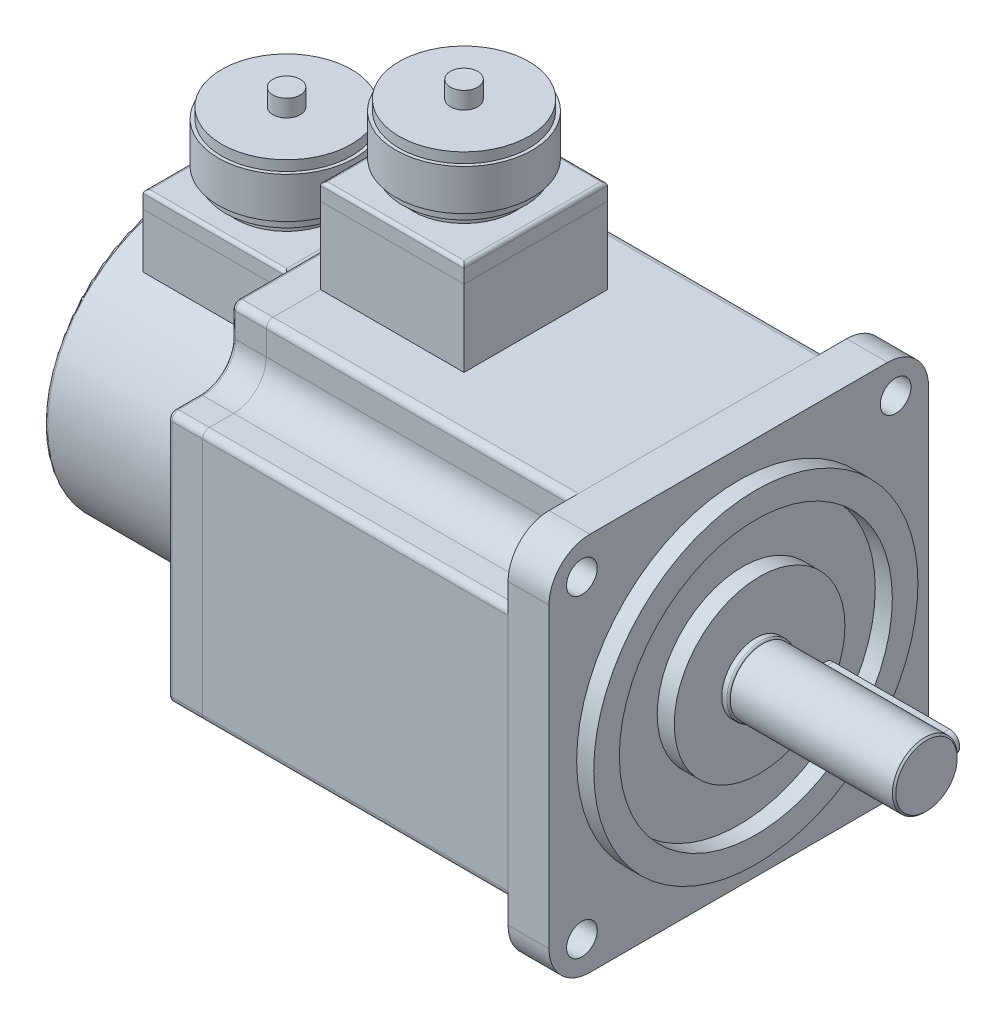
SolidWorks part; units mm, degrees
ref_plane "前视基准面" through (0, 0, 0) normal (0, 0, 1) x (1, 0, 0)
ref_plane "上视基准面" through (0, 0, 0) normal (0, 1, 0) x (1, 0, 0)
ref_plane "右视基准面" through (0, 0, 0) normal (1, 0, 0) x (0, 0, -1)
sketch "草图1" plane through (0, 0, 0) normal (1, 0, 0) x (0, 0, -1)
  line L1 (-43.6, -55.6) -> (43.6, -55.6)
  line L2 (-55.6, -43.6) -> (-55.6, 43.6)
  line L3 (-43.6, 55.6) -> (43.6, 55.6)
  line L4 (55.6, -43.6) -> (55.6, 43.6)
  line L5 (-55.6, -55.6) -> (55.6, 55.6) construction
  line L6 (-55.6, 55.6) -> (55.6, -55.6) construction
  arc A0 (-43.6, -55.6) -> (-55.6, -43.6) centre (-43.6, -43.6) cw
  arc A1 (43.6, -55.6) -> (55.6, -43.6) centre (43.6, -43.6) ccw
  arc A2 (43.6, 55.6) -> (55.6, 43.6) centre (43.6, 43.6) cw
  arc A3 (-55.6, 43.6) -> (-43.6, 55.6) centre (-43.6, 43.6) cw
  point P0 (0, 0)
  dimension "D1" = 12
extrude "凸台-拉伸1" add sketch "草图1" along normal blind 10
sketch "草图2" plane through (10, 0, 0) normal (1, 0, 0) x (0, 0, -1)
  line L0 (43.6, 55.6) -> (-43.6, 55.6) construction
  line L1 (-43.6, -55.6) -> (43.6, -55.6)
  line L2 (-55.6, -43.6) -> (-55.6, 43.6)
  line L3 (-43.6, 55.6) -> (43.6, 55.6)
  line L4 (55.6, -43.6) -> (55.6, 43.6)
  line L5 (-55.6, -55.6) -> (55.6, 55.6) construction
  line L6 (-55.6, 55.6) -> (55.6, -55.6) construction
  arc A0 (43.6, 55.6) -> (55.6, 43.6) centre (43.6, 43.6) cw
  arc A1 (43.6, -55.6) -> (55.6, -43.6) centre (43.6, -43.6) ccw
  arc A2 (-43.6, -55.6) -> (-55.6, -43.6) centre (-43.6, -43.6) cw
  arc A3 (-55.6, 43.6) -> (-43.6, 55.6) centre (-43.6, 43.6) cw
  point P0 (0, 0)
  dimension "D1" = 12
extrude "凸台-拉伸2" add sketch "草图2" along normal blind 89.5 separate body
sketch "草图3" plane through (99.5, 0, 0) normal (1, 0, 0) x (0, 0, -1)
  line L0 (43.6, 55.6) -> (-43.6, 55.6) construction
  line L1 (-43.6, -55.6) -> (43.6, -55.6)
  line L2 (-55.6, -43.6) -> (-55.6, 43.6)
  line L3 (-43.6, 55.6) -> (43.6, 55.6)
  line L4 (55.6, -43.6) -> (55.6, 43.6)
  line L5 (-55.6, -55.6) -> (55.6, 55.6) construction
  line L6 (-55.6, 55.6) -> (55.6, -55.6) construction
  arc A0 (43.6, 55.6) -> (55.6, 43.6) centre (43.6, 43.6) cw
  arc A1 (43.6, -55.6) -> (55.6, -43.6) centre (43.6, -43.6) ccw
  arc A2 (-43.6, -55.6) -> (-55.6, -43.6) centre (-43.6, -43.6) cw
  arc A3 (-55.6, 43.6) -> (-43.6, 55.6) centre (-43.6, 43.6) cw
  point P0 (0, 0)
  dimension "D1" = 12
extrude "凸台-拉伸3" add sketch "草图3" along normal blind 12 separate body
sketch "草图6" plane through (0, 0, 0) normal (-1, 0, 0) x (0, 0, 1)
  line L0 (-46.5, 36.9491) -> (-53.6, 36.9491)
  line L1 (-55.6, 34.9491) -> (-55.6, 43.6)
  line L3 (-43.6, 55.6) -> (-34.9491, 55.6)
  line L4 (34.9491, 55.6) -> (43.6, 55.6)
  line L6 (55.6, 43.6) -> (55.6, 34.9491)
  line L7 (-55.6, -43.6) -> (-55.6, 43.6) construction
  line L9 (-53.6, -36.9491) -> (-46.5, -36.9491)
  line L10 (55.6, -34.9491) -> (55.6, -43.6)
  line L11 (-36.9491, -46.5) -> (-36.9491, -53.6)
  line L12 (43.6, -55.6) -> (-43.6, -55.6) construction
  line L14 (36.9491, -53.6) -> (36.9491, -46.5)
  line L16 (46.5, -36.9491) -> (53.6, -36.9491)
  line L17 (55.6, 43.6) -> (55.6, -43.6) construction
  line L19 (53.6, 36.9491) -> (46.5, 36.9491)
  line L20 (43.6, -55.6) -> (34.9491, -55.6)
  line L21 (36.9491, 46.5) -> (36.9491, 53.6)
  line L24 (-43.6, 55.6) -> (43.6, 55.6) construction
  line L25 (-36.9491, 53.6) -> (-36.9491, 46.5)
  line L26 (-34.9491, -55.6) -> (-43.6, -55.6)
  line L28 (-55.6, -43.6) -> (-55.6, -34.9491)
  arc A0 (-46.5, 36.9491) -> (-36.9491, 46.5) centre (-46.5, 46.5) ccw
  arc A1 (36.9491, 46.5) -> (46.5, 36.9491) centre (46.5, 46.5) ccw
  arc A2 (-36.9491, -46.5) -> (-46.5, -36.9491) centre (-46.5, -46.5) ccw
  arc A3 (46.5, -36.9491) -> (36.9491, -46.5) centre (46.5, -46.5) ccw
  arc A4 (-34.9491, 55.6) -> (-36.9491, 53.6) centre (-34.9491, 53.6) ccw
  arc A5 (36.9491, 53.6) -> (34.9491, 55.6) centre (34.9491, 53.6) ccw
  arc A6 (55.6, 34.9491) -> (53.6, 36.9491) centre (53.6, 34.9491) ccw
  arc A7 (53.6, -36.9491) -> (55.6, -34.9491) centre (53.6, -34.9491) ccw
  arc A8 (34.9491, -55.6) -> (36.9491, -53.6) centre (34.9491, -53.6) ccw
  arc A9 (-36.9491, -53.6) -> (-34.9491, -55.6) centre (-34.9491, -53.6) ccw
  arc A10 (-55.6, -34.9491) -> (-53.6, -36.9491) centre (-53.6, -34.9491) ccw
  arc A11 (-53.6, 36.9491) -> (-55.6, 34.9491) centre (-53.6, 34.9491) ccw
  arc A12 (-43.6, 55.6) -> (-55.6, 43.6) centre (-43.6, 43.6) ccw
  arc A13 (55.6, 43.6) -> (43.6, 55.6) centre (43.6, 43.6) ccw
  arc A14 (43.6, -55.6) -> (55.6, -43.6) centre (43.6, -43.6) ccw
  arc A15 (-55.6, -43.6) -> (-43.6, -55.6) centre (-43.6, -43.6) ccw
  point P0 (0, 0)
  point P10 (-36.9491, 55.6)
  point P41 (55.6, 36.9491)
  point P44 (55.6, -36.9491)
  point P47 (36.9491, -55.6)
  point P50 (-36.9491, -55.6)
  point P53 (-55.6, -36.9491)
  point P56 (-55.6, 36.9491)
  dimension "D1" = 2
extrude "切除-拉伸1" cut sketch "草图6" against normal blind 99.5
fillet "圆角1" radius 1 24 edges at (0, 55.6, 0) (0, 55.0142, 36.3633) (0, 50.05, 36.9491) (0, 39.7465, 39.7465) (0, 36.9491, 50.05) (0, 36.3633, 55.0142) (0, 0, 55.6) (0, -36.3633, 55.0142) (0, -36.9491, 50.05) (0, -39.7465, 39.7465) (0, -50.05, 36.9491) (0, -55.0142, 36.3633) (0, -55.6, 0) (0, -55.0142, -36.3633) (0, -50.05, -36.9491) (0, -39.7465, -39.7465) (0, -36.9491, -50.05) (0, -36.3633, -55.0142) (0, 0, -55.6) (0, 36.3633, -55.0142) (0, 36.9491, -50.05) (0, 39.7465, -39.7465) (0, 50.05, -36.9491) (0, 55.0142, -36.3633)
sketch "草图7" plane through (111.5, 0, 0) normal (1, 0, 0) x (0, 0, -1)
  circle A2 centre (-45.9619, 45.9619) radius 4.5
  circle A3 centre (45.9619, 45.9619) radius 4.5
  circle A4 centre (45.9619, -45.9619) radius 4.5
  circle A5 centre (-45.9619, -45.9619) radius 4.5
extrude "切除-拉伸2" cut sketch "草图7" against normal blind 12
sketch "草图8" plane through (111.5, 0, 0) normal (1, 0, 0) x (0, 0, -1)
  circle A0 centre (0, 0) radius 47.5
  circle A1 centre (0, 0) radius 40
  circle A2 centre (1.1033, 0) radius 25
extrude "凸台-拉伸4" add sketch "草图8" along normal blind 5 contours A0 A1 | A2
sketch "草图9" plane through (116.5, 0, 0) normal (1, 0, 0) x (0, 0, -1)
  circle A0 centre (0, 0) radius 10
extrude "凸台-拉伸5" add sketch "草图9" along normal blind 2 separate body
sketch "草图10" plane through (118.5, 0, 0) normal (1, 0, 0) x (0, 0, -1)
  circle A0 centre (0, 0) radius 9.5
extrude "凸台-拉伸6" add sketch "草图10" along normal blind 48 separate body
fillet "圆角2" radius 0.5 1 edges at (118.5, 0, -10)
ref_plane "基准面1" through (0, 0, -9.75) normal (0, 0, 1) x (1, 0, 0)
sketch "草图11" plane through (0, 0, -9.75) normal (0, 0, 1) x (1, 0, 0)
  line L5 (161, 3) -> (127, 3)
  line L7 (127, -3) -> (161, -3)
  arc A0 (161, -3) -> (161, 3) centre (161, 0) ccw
  arc A1 (127, 3) -> (127, -3) centre (127, 0) ccw
chamfer "倒角1" distance 0.5 angle 45 1 edges at (166.5, 0, -9.5)
sketch "草图13" plane through (0, 0, 0) normal (-1, 0, 0) x (0, 0, 1)
  circle A0 centre (0, 0) radius 40
extrude "凸台-拉伸8" add sketch "草图13" along normal blind 52 separate body
ref_plane "基准面2" through (0, 40, 0) normal (0, 1, 0) x (1, 0, 0)
sketch "草图14" plane through (0, 40, 0) normal (0, 1, 0) x (1, 0, 0)
  line L2 (-42, -21) -> (0, -21)
  line L3 (-42, -21) -> (-42, 21)
  line L4 (-42, 21) -> (0, 21)
  line L5 (0, -21) -> (0, 21)
  line L6 (-42, -21) -> (0, 21) construction
  line L7 (-42, 21) -> (0, -21) construction
extrude "切除-拉伸4" cut sketch "草图14" against normal blind 10
sketch "草图15" plane through (0, 30, 0) normal (0, 1, 0) x (1, 0, 0)
  line L1 (-42, -21) -> (0, -21)
  line L2 (-42, -21) -> (-42, 21)
  line L3 (-42, 21) -> (0, 21)
  line L4 (0, -21) -> (0, 21)
  line L5 (-42, -21) -> (0, 21) construction
  line L6 (-42, 21) -> (0, -21) construction
  point P0 (-21, 0)
extrude "凸台-拉伸9" add sketch "草图15" along normal blind 20
sketch "草图16" plane through (0, 50, 0) normal (0, 1, 0) x (1, 0, 0)
  line L0 (-42, 21) -> (0, 21) construction
  line L1 (-42, -21) -> (0, -21)
  line L2 (-42, -21) -> (-42, 21)
  line L3 (-42, 21) -> (0, 21)
  line L4 (0, -21) -> (0, 21)
  line L5 (-42, -21) -> (0, 21) construction
  line L6 (-42, 21) -> (0, -21) construction
  line L7 (0, 21) -> (-42, 21) construction
  point P0 (-21, 0)
extrude "凸台-拉伸10" add sketch "草图16" along normal blind 5 separate body
fillet "圆角3" radius 1 4 edges at (-21, 55, 21) (-42, 55, 0) (-21, 55, -21) (0, 55, 0)
sketch "草图17" plane through (0, 55, 0) normal (0, 1, 0) x (1, 0, 0)
  circle A0 centre (-21, 0) radius 15
extrude "凸台-拉伸11" add sketch "草图17" along normal blind 3 separate body
sketch "草图18" plane through (0, 58, 0) normal (0, 1, 0) x (1, 0, 0)
  circle A0 centre (-21, 0) radius 18
extrude "凸台-拉伸12" add sketch "草图18" along normal blind 3
sketch "草图19" plane through (0, 61, 0) normal (0, 1, 0) x (1, 0, 0)
  circle A0 centre (-21, 0) radius 20
extrude "凸台-拉伸13" add sketch "草图19" along normal blind 12
sketch "草图20" plane through (0, 73, 0) normal (0, 1, 0) x (1, 0, 0)
  circle A0 centre (-21, 0) radius 19
extrude "凸台-拉伸14" add sketch "草图20" along normal blind 3
sketch "草图21" plane through (0, 76, 0) normal (0, 1, 0) x (1, 0, 0)
  circle A0 centre (-21, 0) radius 4
extrude "凸台-拉伸15" add sketch "草图21" along normal blind 5
sketch "草图22" plane through (0, 55.6, 0) normal (0, 1, 0) x (1, 0, 0)
  line L3 (10, -21) -> (52, -21)
  line L4 (10, -21) -> (10, 21)
  line L5 (10, 21) -> (52, 21)
  line L6 (52, -21) -> (52, 21)
  line L7 (10, -21) -> (52, 21) construction
  line L8 (10, 21) -> (52, -21) construction
extrude "凸台-拉伸16" add sketch "草图22" along normal blind 22.4 separate body
sketch "草图23" plane through (0, 78, 0) normal (0, 1, 0) x (1, 0, 0)
  line L2 (52, 21) -> (10, 21) construction
  line L4 (10, -21) -> (52, -21)
  line L5 (10, -21) -> (10, 21)
  line L6 (10, 21) -> (52, 21)
  line L7 (52, -21) -> (52, 21)
  line L8 (10, -21) -> (52, 21) construction
  line L9 (10, 21) -> (52, -21) construction
  point P6 (31, 0)
extrude "凸台-拉伸17" add sketch "草图23" along normal blind 5 separate body
fillet "圆角4" radius 1 4 edges at (31, 83, 21) (10, 83, 0) (31, 83, -21) (52, 83, 0)
sketch "草图24" plane through (0, 83, 0) normal (0, 1, 0) x (1, 0, 0)
  circle A0 centre (31, 0) radius 15
extrude "凸台-拉伸18" add sketch "草图24" along normal blind 3 separate body
sketch "草图25" plane through (0, 86, 0) normal (0, 1, 0) x (1, 0, 0)
  circle A0 centre (31, 0) radius 18
extrude "凸台-拉伸19" add sketch "草图25" along normal blind 3 separate body
sketch "草图26" plane through (0, 89, 0) normal (0, 1, 0) x (1, 0, 0)
  circle A0 centre (31, 0) radius 20
extrude "凸台-拉伸20" add sketch "草图26" along normal blind 12 separate body
sketch "草图27" plane through (0, 101, 0) normal (0, 1, 0) x (1, 0, 0)
  circle A0 centre (31, 0) radius 19
extrude "凸台-拉伸21" add sketch "草图27" along normal blind 3 separate body
sketch "草图28" plane through (0, 104, 0) normal (0, 1, 0) x (1, 0, 0)
  circle A0 centre (31, 0) radius 4
extrude "凸台-拉伸22" add sketch "草图28" along normal blind 5 separate body
fillet "圆角5" radius 1 1 edges at (-52, 0, 40)
extrude "切除-拉伸5" cut sketch "草图11" along normal blind 3.5
sketch "草图33" plane through (0, 0, -6.25) normal (0, 0, -1) x (-1, 0, 0)
  line L0 (-161, 3) -> (-127, 3)
  line L2 (-127, -3) -> (-161, -3)
  arc A0 (-161, 3) -> (-161, -3) centre (-161, 0) ccw
  arc A1 (-127, -3) -> (-127, 3) centre (-127, 0) ccw
extrude "凸台-拉伸25" add sketch "草图33" along normal blind 6 separate body
